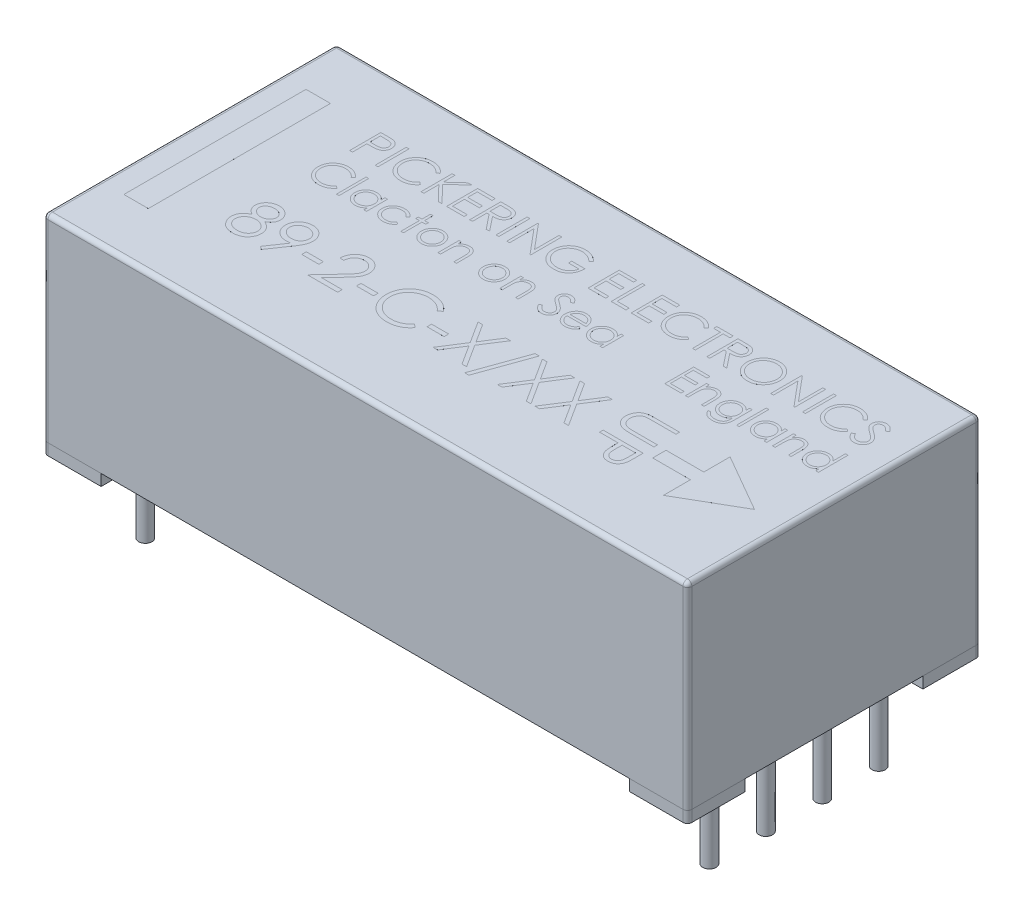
SolidWorks part; units mm, degrees
ref_plane "Front Plane" through (0, 0, 0) normal (0, 0, 1) x (1, 0, 0)
ref_plane "Top Plane" through (0, 0, 0) normal (0, 1, 0) x (1, 0, 0)
ref_plane "Right Plane" through (0, 0, 0) normal (1, 0, 0) x (0, 0, -1)
sketch "Sketch2" plane through (0, 0, 0) normal (0, 1, 0) x (1, 0, 0)
  line L1 (14.5, -6.6) -> (-14.5, -6.6)
  line L2 (14.5, -6.6) -> (14.5, 6.6)
  line L3 (14.5, 6.6) -> (-14.5, 6.6)
  line L4 (-14.5, -6.6) -> (-14.5, 6.6)
  line L5 (14.5, -6.6) -> (-14.5, 6.6) construction
  line L6 (14.5, 6.6) -> (-14.5, -6.6) construction
  point P0 (0, 0)
  dimension "D1" = 13.2
  dimension "D2" = 29
extrude "Main Body" add sketch "Sketch2" along normal blind 8.89 draft 0.023
sketch "Sketch9" plane through (0, 0, 0) normal (0, -1, 0) x (1, 0, 0)
  line L0 (14.5, -6.6) -> (-14.5, -6.6) construction
  line L1 (14.5, 6.6) -> (14.5, -6.6) construction
  circle A0 centre (12.7, -3.81) radius 0.3
  circle A1 centre (12.7, -1.27) radius 0.2963
  circle A2 centre (12.7, 1.27) radius 0.3
  circle A3 centre (12.7, 3.81) radius 0.3
  dimension "D1" = 0.6
  dimension "D5" = 0.6
  dimension "D7" = 0.6
  dimension "D2" = 2.79
  dimension "D3" = 2.54
  dimension "D4" = 1.8
  dimension "D6" = 2.54
  dimension "D8" = 2.54
extrude "Pins" add sketch "Sketch9" along normal blind 4.31
mirror "Mirror2" about plane through (0, 0, 0) normal (1, 0, 0) of "Pins"
sketch "Sketch10" plane through (0, 0, 0) normal (0, -1, 0) x (1, 0, 0)
  line L1 (14.5, 6.6) -> (11.9, 6.6)
  line L2 (14.5, 6.6) -> (14.5, 4)
  line L3 (14.5, 4) -> (11.9, 4)
  line L4 (11.9, 6.6) -> (11.9, 4)
  dimension "D1" = 2.6
  dimension "D2" = 2.6
extrude "Foot" add sketch "Sketch10" along normal blind 0.51
sketch "Sketch11" plane through (0, -0.51, 0) normal (0, -1, 0) x (1, 0, 0)
  line L0 (14.5, 6.6) -> (11.9, 6.6) construction
  line L1 (11.9, 4) -> (13.95, 4)
  line L2 (11.9, 4) -> (11.9, 6.05)
  line L3 (11.9, 6.05) -> (13.95, 6.05)
  line L4 (13.95, 4) -> (13.95, 6.05)
  line L5 (14.5, 4) -> (14.5, 6.6) construction
  dimension "D1" = 0.55
  dimension "D2" = 0.55
extrude "Extrude2" cut sketch "Sketch11" against normal up to surface (0.51 mm away)
mirror "Mirror3" about plane through (0, 0, 0) normal (0, 0, 1) of "Extrude2", "Foot"
mirror "Mirror4" about plane through (0, 0, 0) normal (1, 0, 0) of "Mirror3", "Foot", "Extrude2"
sketch "Sketch12"
  dimension "D1" = 1.1
  dimension "D2" = 8.2
  dimension "D3" = 2.4965
  dimension "D4" = 1.4
  dimension "D5" = 2
  dimension "D6" = 3.8
extrude "Lettering" add sketch "Sketch12" along normal blind 0.0001
fillet "Fillet1" radius 0.2 12 edges at (-14.5, -0.255, -6.6) (14.5, -0.255, -6.6) (14.5, -0.255, 6.6) (-14.5, -0.255, 6.6) (-14.4983, 4.445, -6.5983) (14.4983, 4.445, -6.5983) (0, 8.89, -6.5965) (14.4983, 4.445, 6.5983) (14.4965, 8.89, 0) (-14.4983, 4.445, 6.5983) (-14.4965, 8.89, 0) (0, 8.89, 6.5965)
sketch "Sketch13"
sketch_block_instance "UP-1"
sketch_block "UP"
sketch_block_instance "Block1-1"
sketch_block "Block1" parameters "D1"=1.7, "D2"=2.2, "D3"=2.6, "D4"=1.24
extrude "Arrow" add sketch "Sketch13" along normal blind 0.0001
